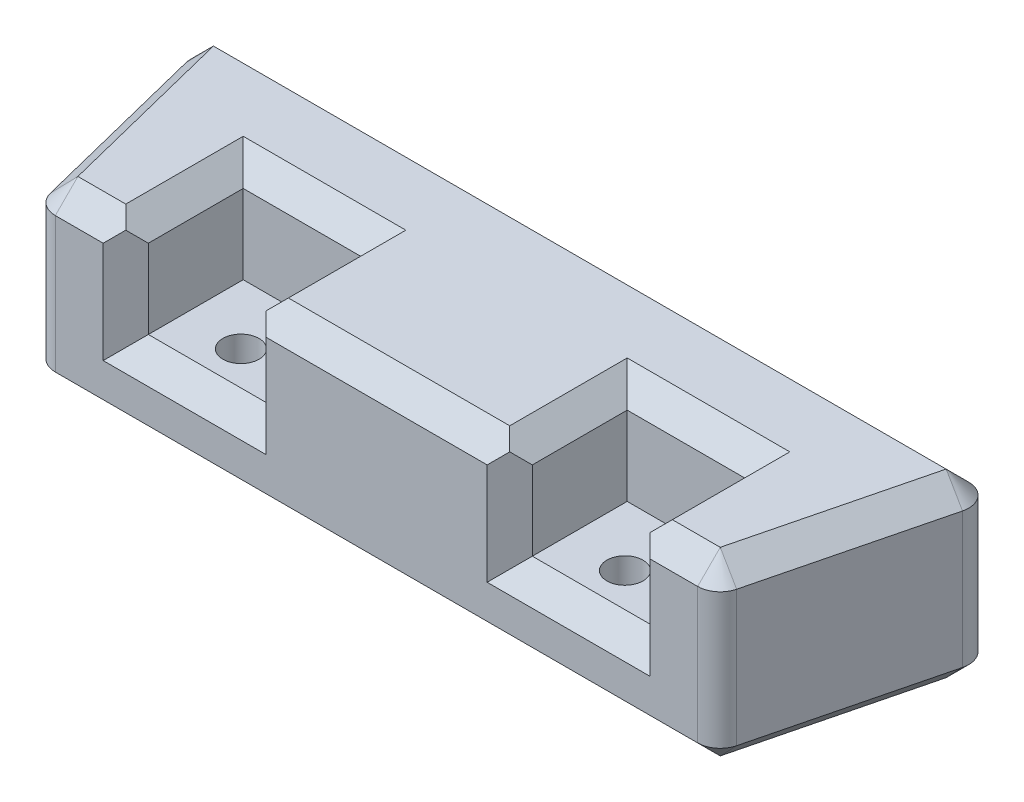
SolidWorks part; units mm, degrees
ref_plane "Plano frontal" through (0, 0, 0) normal (0, 0, 1) x (1, 0, 0)
ref_plane "Plano superior" through (0, 0, 0) normal (0, 1, 0) x (1, 0, 0)
ref_plane "Plano direito" through (0, 0, 0) normal (1, 0, 0) x (0, 0, -1)
sketch "Esboço2" plane through (0, 0, 0) normal (0, 1, 0) x (1, 0, 0)
  line L4 (-0.1894, 0.7575) -> (-2.1894, 8.7575)
  line L6 (32.1894, 8.7575) -> (30.1894, 0.7575)
  line L7 (29.2192, 0) -> (0.7808, 0)
  line L8 (-1.2192, 10) -> (31.2192, 10)
  arc A1 (30.1894, 0.7575) -> (29.2192, 0) centre (29.2192, 1) cw
  arc A2 (-0.1894, 0.7575) -> (0.7808, 0) centre (0.7808, 1) ccw
  arc A5 (32.1894, 8.7575) -> (31.2192, 10) centre (31.2192, 9) ccw
  arc A6 (-2.1894, 8.7575) -> (-1.2192, 10) centre (-1.2192, 9) cw
  point P1 (0, 0)
  point P2 (15, 10)
  point P6 (15, 0)
  point P7 (32.5, 10)
  point P10 (30, 0)
  point P13 (0, 0)
  point P18 (-2.5, 10)
  dimension "D4" = 1
  dimension "D5" = 35
  dimension "D2" = 10
  dimension "D3" = 1
  dimension "D1" = 30
extrude "Ressalto-extrusão2" add sketch "Esboço2" along normal blind 8
sketch "Esboço4" plane through (0, 8, 0) normal (0, 1, 0) x (1, 0, 0)
  line L0 (15, 0) -> (15, 2.6) construction
  line L1 (0.7808, 0) -> (29.2192, 0) construction
  line L2 (6.5, 2.6) -> (23.5, 2.6) construction
  line L4 (20.9, 0) -> (26.1, 0)
  line L5 (20.9, 0) -> (20.9, 5.2)
  line L6 (20.9, 5.2) -> (26.1, 5.2)
  line L7 (26.1, 0) -> (26.1, 5.2)
  line L8 (20.9, 0) -> (26.1, 5.2) construction
  line L9 (20.9, 5.2) -> (26.1, 0) construction
  line L10 (9.1, 0) -> (3.9, 0)
  line L11 (9.1, 0) -> (9.1, 5.2)
  line L12 (9.1, 5.2) -> (3.9, 5.2)
  line L13 (3.9, 0) -> (3.9, 5.2)
  line L14 (9.1, 0) -> (3.9, 5.2) construction
  line L15 (9.1, 5.2) -> (3.9, 0) construction
  point P7 (15, 2.6)
  dimension "D1" = 17
  dimension "D2" = 2.6
  dimension "D3" = 5.2
  dimension "D4" = 5.2
extrude "Corte-extrusão1" cut sketch "Esboço4" against normal offset from surface (4.5 mm away) 3.5
chamfer "Chanfro1" distance 1 angle 45 16 edges at (9.1, 8, -2.6) (6.5, 8, -5.2) (3.9, 8, -2.6) (2.3404, 8, 0) (0.1654, 8, -0.2118) (-1.1894, 8, -4.7575) (31.1894, 8, -4.7575) (29.8346, 8, -0.2118) (27.6596, 8, 0) (26.1, 8, -2.6) (23.5, 8, -5.2) (20.9, 8, -2.6) (15, 8, 0) (15, 8, -10) (-2.0074, 8, -9.6154) (32.0074, 8, -9.6154)
chamfer "Chanfro2" distance 1 angle 45 14 edges at (0.1654, 0, -0.2118) (-1.1894, 0, -4.7575) (31.1894, 0, -4.7575) (29.8346, 0, -0.2118) (15, 0, 0) (26.1, 5.25, 0) (23.5, 3.5, 0) (20.9, 5.25, 0) (9.1, 5.25, 0) (6.5, 3.5, 0) (3.9, 5.25, 0) (15, 0, -10) (-2.0074, 0, -9.6154) (32.0074, 0, -9.6154)
sketch "Esboço5" plane through (0, 3.5, 0) normal (0, 1, 0) x (1, 0, 0)
  line L0 (6.5, 2.5) -> (6.5, 0) construction
  line L1 (6.5, 2.5) -> (9.1, 2.5) construction
  line L2 (9.1, 5.2) -> (9.1, 1) construction
  line L3 (10.1, 0) -> (2.9, 0) construction
  line L4 (27.1, 0) -> (19.9, 0) construction
  line L5 (26.1, 1) -> (26.1, 5.2) construction
  point P0 (6.5, 2.5)
  point P1 (23.5, 2.5)
  point P7 (0, 0)
  dimension "D1" = 2.5
  dimension "D2" = 2.6
  dimension "D3" = 2.5
  dimension "D4" = 2.6
hole_wizard "Furo roscado de M21" positions "3DSketch1" profile "Esboço6" tap size "M2" standard "ISO"
sketch3d "3DSketch1"
  point P0 (23.5, 3.5, -2.5)
  point P3 (6.5, 3.5, -2.5)
sketch "Esboço6" plane through (23.5, 3.5, -2.5) normal (1, 0, 0) x (0, 0, 1)
  line L0 (0, 0) -> (0, 3.5)
  line L1 (0, 3.5) -> (0.8, 3.5)
  line L2 (0.8, 3.5) -> (0.8, 0)
  line L5 (0.8, 0) -> (0, 0)
  line L11 (0, -6.35) -> (0, 107.95) construction
  dimension "Thru Tap Drill Dia." = 1.6
  dimension "Thru Tap Drill Depth" = 3.5
